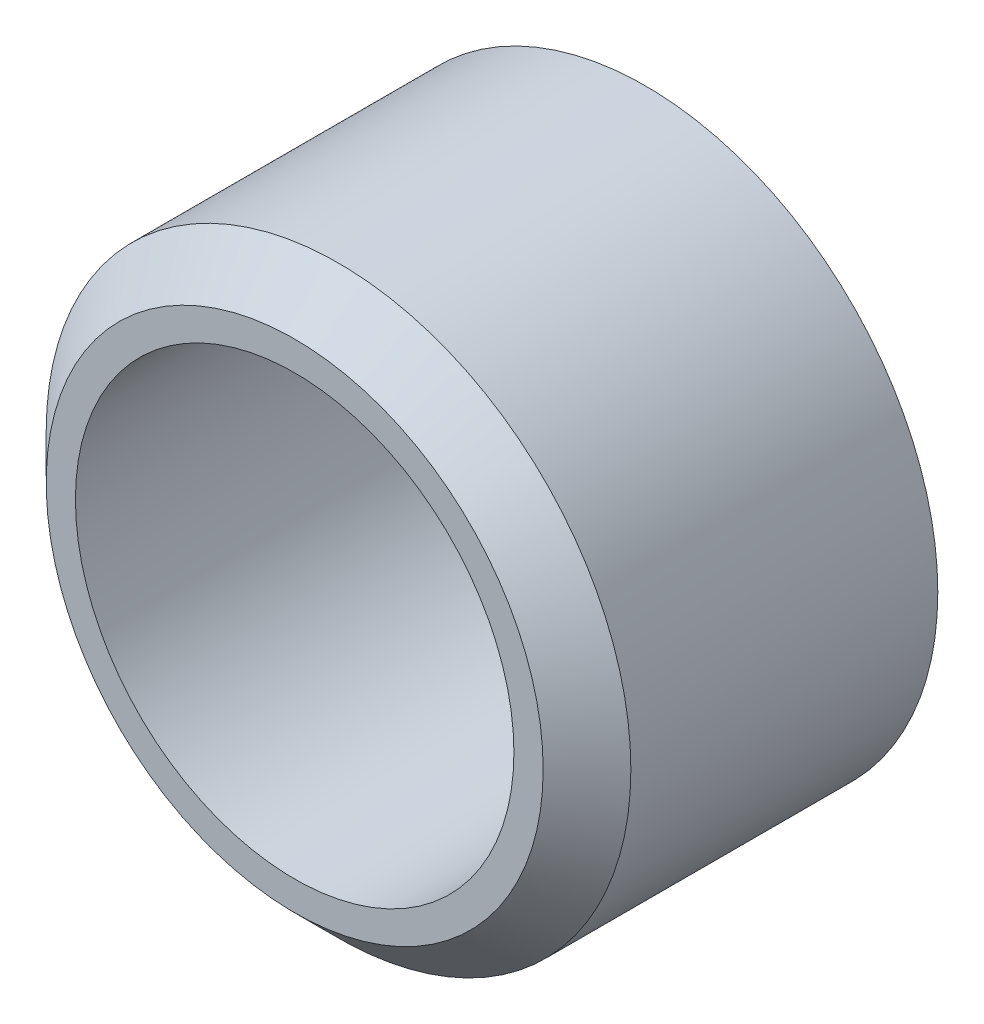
SolidWorks part; units mm, degrees
ref_plane "Спереди" through (0, 0, 0) normal (0, 0, 1) x (1, 0, 0)
ref_plane "Сверху" through (0, 0, 0) normal (0, 1, 0) x (1, 0, 0)
ref_plane "Справа" through (0, 0, 0) normal (1, 0, 0) x (0, 0, -1)
sketch "Эскиз1" plane through (0, 0, 0) normal (0, 0, 1) x (1, 0, 0)
  circle A0 centre (0, 0) radius 15
  circle A1 centre (0, 0) radius 20
extrude "Бобышка-Вытянуть1" add sketch "Эскиз1" along normal blind 24
chamfer "Фаска1" distance 3 angle 45 1 edges at (20, 0, 24)
